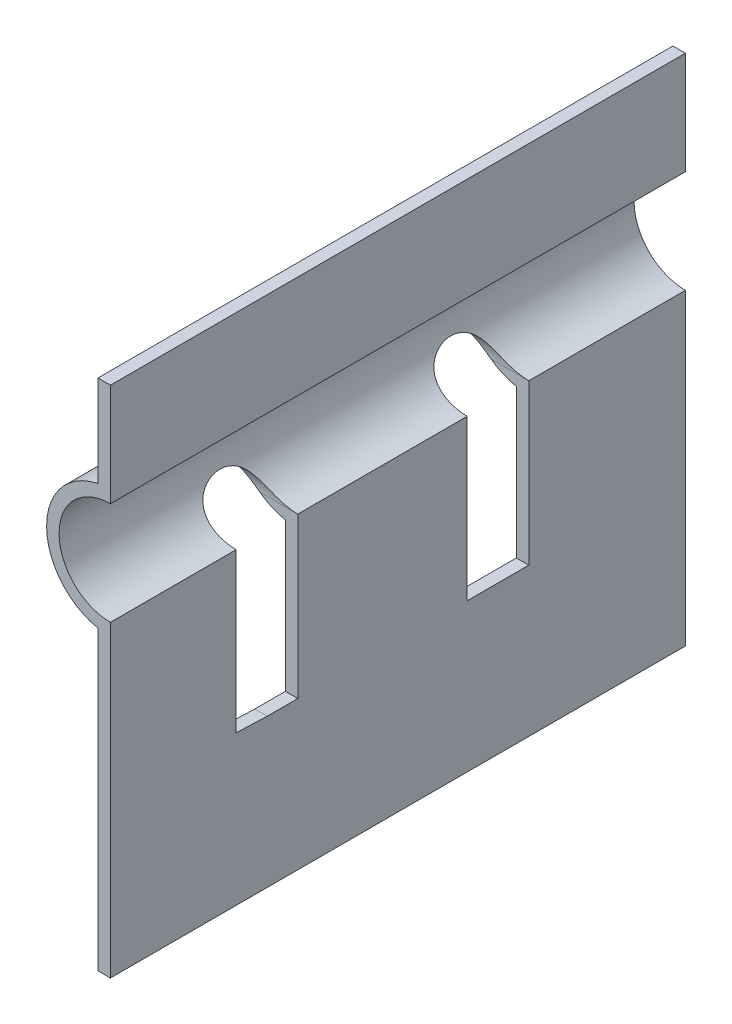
SolidWorks part; units mm, degrees
ref_plane "Front Plane" through (0, 0, 0) normal (0, 0, 1) x (1, 0, 0)
ref_plane "Top Plane" through (0, 0, 0) normal (0, 1, 0) x (1, 0, 0)
ref_plane "Right Plane" through (0, 0, 0) normal (1, 0, 0) x (0, 0, -1)
sketch "Sketch1" plane through (0, 0, 0) normal (0, 0, 1) x (1, 0, 0)
  line L0 (0, 0) -> (0, -10)
  line L1 (0, -20) -> (0, -50)
  line L2 (-1.214, 0) -> (-1.214, -8.9057)
  line L3 (-1.214, -21.0943) -> (-1.214, -50)
  line L4 (-1.214, -50) -> (0, -50)
  line L5 (-1.214, 0) -> (0, 0)
  arc A0 (0, -10) -> (0, -20) centre (0, -15) ccw
  arc A1 (-1.214, -8.9057) -> (-1.214, -21.0943) centre (0, -15) ccw
  dimension "D3" = 5
  dimension "D2" = 50
  dimension "D4" = 30
  dimension "D1" = 1.214
extrude "Extrude1" add sketch "Sketch1" along normal blind 56
sketch "Sketch2" plane through (0, 0, 0) normal (1, 0, 0) x (0, 0, -1)
  line L0 (-43.75, -35.4447) -> (-40.7247, -35.5557)
  line L2 (-40.75, -20) -> (-18.25, -20) construction
  line L3 (-56, -20) -> (0, -20) construction
  line L4 (-37.75, -20) -> (-37.75, -35.5557)
  line L5 (-37.75, -35.5557) -> (-40.7247, -35.5557)
  line L6 (-43.75, -20) -> (-43.75, -35.4447)
  line L7 (-56, -50) -> (-56, -20) construction
  line L8 (-15.25, -20) -> (-15.25, -35.5557)
  line L9 (-15.25, -35.5557) -> (-21.25, -35.5557)
  line L10 (-21.25, -20) -> (-21.25, -35.5557)
  arc A0 (-37.75, -20) -> (-43.75, -20) centre (-40.75, -20) ccw
  arc A1 (-15.25, -20) -> (-21.25, -20) centre (-18.25, -20) ccw
  dimension "D1" = 3
  dimension "D4" = 3
  dimension "D2" = 22.5
  dimension "D3" = 15.25
extrude "Extrude2" cut sketch "Sketch2" against normal blind 56
